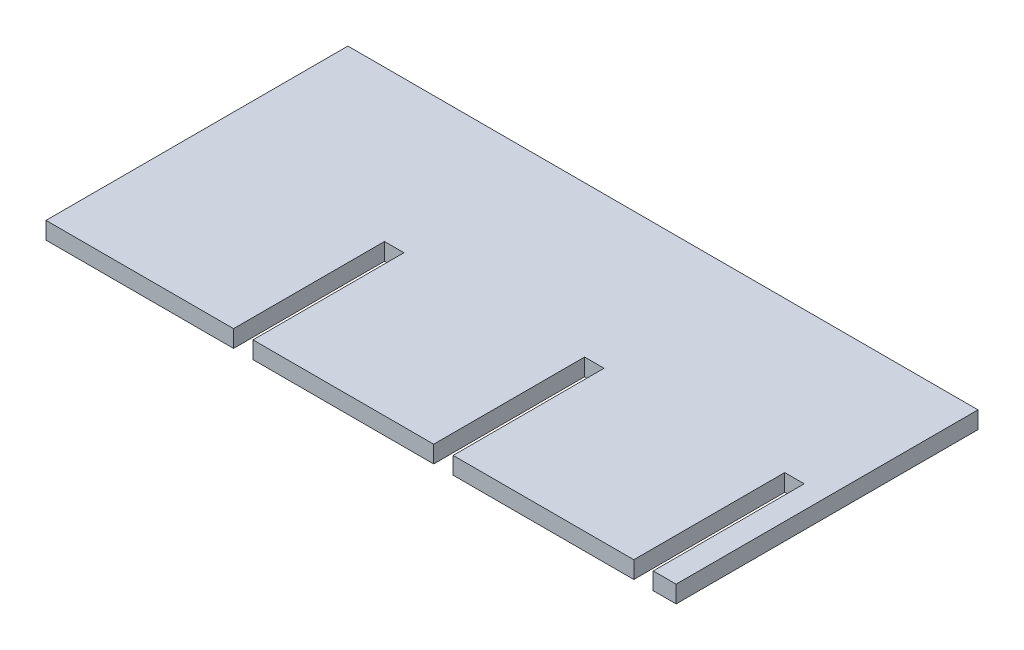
SolidWorks part; units mm, degrees
ref_plane "Alzado" through (0, 0, 0) normal (0, 0, 1) x (1, 0, 0)
ref_plane "Planta" through (0, 0, 0) normal (0, 1, 0) x (1, 0, 0)
ref_plane "Vista lateral" through (0, 0, 0) normal (1, 0, 0) x (0, 0, -1)
sketch "Croquis14" plane through (0, 0, 0) normal (0, 0, 1) x (1, 0, 0)
  line L0 (-34.75, -19.25) -> (-34.75, -20.75)
  line L1 (-35, -19) -> (35, -19) construction
  line L2 (-35, -19) -> (-35, -21) construction
  line L3 (-35, -21) -> (35, -21) construction
  line L4 (35, -19) -> (35, -21) construction
  line L5 (-34.75, -20.75) -> (34.75, -20.75)
  line L6 (34.75, -19.25) -> (34.75, -20.75)
  line L7 (-34.75, -19.25) -> (34.75, -19.25)
  dimension "D1" = 0.25
extrude "Saliente-Extruir8" add sketch "Croquis14" along normal blind 26.4
sketch "Croquis17" plane through (0, -20.75, 0) normal (0, -1, 0) x (1, 0, 0)
  line L0 (-18.35, 13.2) -> (-16.65, 13.2)
  line L3 (-18.35, 26.4) -> (-16.65, 26.4)
  line L9 (-18.35, 13.2) -> (-18.35, 26.4)
  line L10 (34.75, 26.4) -> (-34.75, 26.4) construction
  line L11 (-16.65, 13.2) -> (-16.65, 26.4)
  line L12 (-34.75, 26.4) -> (34.75, 26.4) construction
  line L13 (18.35, 26.4) -> (16.65, 26.4)
  line L14 (18.35, 26.4) -> (18.35, 13.2)
  line L15 (18.35, 13.2) -> (16.65, 13.2)
  line L16 (16.65, 26.4) -> (16.65, 13.2)
  line L17 (34.75, 26.4) -> (34.75, 0) construction
  line L19 (0.85, 26.4) -> (-0.85, 26.4)
  line L20 (0.85, 26.4) -> (0.85, 13.2)
  line L21 (0.85, 13.2) -> (-0.85, 13.2)
  line L22 (-0.85, 26.4) -> (-0.85, 13.2)
  dimension "D1" = 1.7
  dimension "D2" = 13.2
  dimension "D3" = 13.2
  dimension "D4" = 1.7
  dimension "D5" = 16.4
  dimension "D6" = 1.7
  dimension "D7" = 13.2
  dimension "D8" = 15.8
extrude "Cortar-Extruir1" cut sketch "Croquis17" against normal up to surface (1.5 mm away)
sketch "Croquis18" plane through (0, -20.75, 0) normal (0, -1, 0) x (1, 0, 0)
  line L0 (-34.75, 0) -> (34.75, 0) construction
  line L1 (34.75, 26.4) -> (20.35, 26.4)
  line L2 (34.75, 26.4) -> (34.75, 0)
  line L3 (34.75, 0) -> (20.35, 0)
  line L4 (20.35, 26.4) -> (20.35, 0)
  line L5 (18.35, 13.2) -> (18.35, 26.4) construction
  dimension "D1" = 2
extrude "Cortar-Extruir2" cut sketch "Croquis18" against normal up to surface (1.5 mm away)
